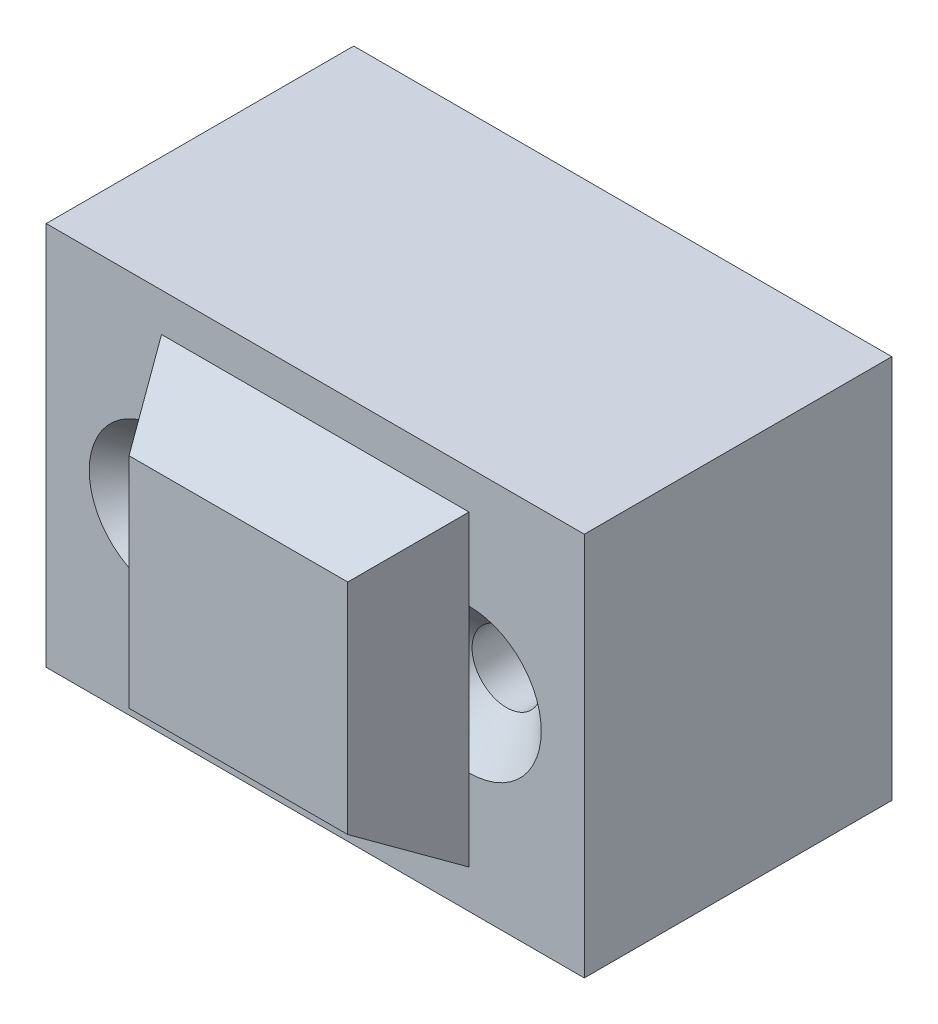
SolidWorks part; units mm, degrees
ref_plane "Plan de face" through (0, 0, 0) normal (0, 0, 1) x (1, 0, 0)
ref_plane "Plan de dessus" through (0, 0, 0) normal (0, 1, 0) x (1, 0, 0)
ref_plane "Plan de droite" through (0, 0, 0) normal (1, 0, 0) x (0, 0, -1)
sketch "Esquisse1" plane through (0, 0, 0) normal (0, 0, 1) x (1, 0, 0)
  line L1 (0, 0) -> (35, 0)
  line L2 (0, 0) -> (0, 25)
  line L3 (0, 25) -> (35, 25)
  line L4 (35, 0) -> (35, 25)
  dimension "D1" = 35
  dimension "D2" = 25
extrude "Extrusion1" add sketch "Esquisse1" along normal blind 20
hole_wizard "Fraisage pour vis à tête fraisée M41" positions "Esquisse3" profile "Esquisse2" countersink size "M4" standard "ISO"
sketch "Esquisse3" plane through (0, 0, 20) normal (0, 0, 1) x (1, 0, 0)
  line L0 (35, 0) -> (35, 25) construction
  line L1 (0, 0) -> (35, 0) construction
  line L2 (0, 25) -> (0, 0) construction
  point P0 (7.5, 12.5)
  point P1 (27.5, 12.5)
  dimension "D1" = 7.5
  dimension "D2" = 12.5
  dimension "D3" = 7.5
sketch "Esquisse2" plane through (7.5, 12.5, 20) normal (1, 0, 0) x (0, -1, 0)
  line L0 (0, 0) -> (0, 20)
  line L1 (0, 20) -> (2.25, 20)
  line L2 (2.25, 20) -> (2.25, 2.45)
  line L3 (2.25, 2.45) -> (4.7, 0)
  line L5 (4.7, 0) -> (0, 0)
  line L6 (-2.25, 2.45) -> (-4.7, 0) construction
  line L11 (0, -6.35) -> (0, 107.95) construction
  dimension "Diamètre du perçage jusqu'au prochain" = 4.5
  dimension "Profondeur du perçage jusqu'au prochain" = 20
  dimension "Diamètre du fraisage entrant" = 9.4
  dimension "Angle du fraisage entrant" = 90
sketch "Esquisse4" plane through (0, 0, 20) normal (0, 0, 1) x (1, 0, 0)
  line L0 (35, 25) -> (0, 25) construction
  line L1 (7.5, 22.5) -> (27.5, 22.5)
  line L2 (7.5, 22.5) -> (7.5, 2.5)
  line L3 (7.5, 2.5) -> (27.5, 2.5)
  line L4 (27.5, 22.5) -> (27.5, 2.5)
  line L5 (35, 0) -> (35, 25) construction
  dimension "D1" = 20
  dimension "D2" = 20
  dimension "D3" = 2.5
  dimension "D4" = 7.5
extrude "Extrusion2" add sketch "Esquisse4" along normal blind 5 draft 30
